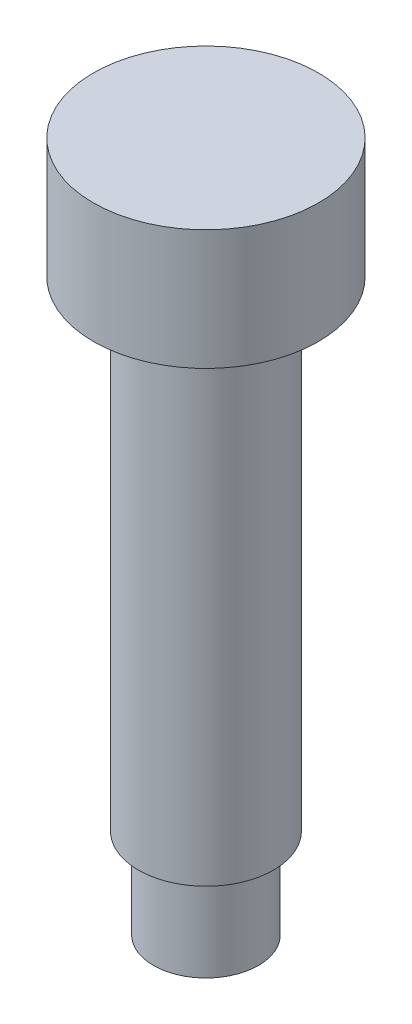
SolidWorks part; units mm, degrees
ref_plane "Front Plane" through (0, 0, 0) normal (0, 0, 1) x (1, 0, 0)
ref_plane "Top Plane" through (0, 0, 0) normal (0, 1, 0) x (1, 0, 0)
ref_plane "Right Plane" through (0, 0, 0) normal (1, 0, 0) x (0, 0, -1)
sketch "Sketch1" plane through (0, 0, 0) normal (0, 0, 1) x (1, 0, 0)
  line L0 (0, 0) -> (0, 18.2563)
  line L1 (0, 18.2563) -> (2.9766, 18.2563)
  line L2 (2.9766, 18.2563) -> (2.9766, 15.0813)
  line L3 (2.9766, 15.0813) -> (1.7859, 15.0813)
  line L4 (1.7859, 15.0813) -> (1.7859, 2.3813)
  line L5 (1.7859, 2.3813) -> (1.3891, 2.3813)
  line L6 (1.3891, 2.3813) -> (1.3891, 0)
  line L7 (1.3891, 0) -> (0, 0)
  line L8 (0, 0) -> (0, -6.3607) construction
  dimension "D1" = 2.7781
  dimension "D2" = 2.3813
  dimension "D3" = 3.5719
  dimension "D4" = 12.7
  dimension "D5" = 5.9531
  dimension "D6" = 3.175
revolve "Revolve1" add sketch "Sketch1" angle 360 about L8
